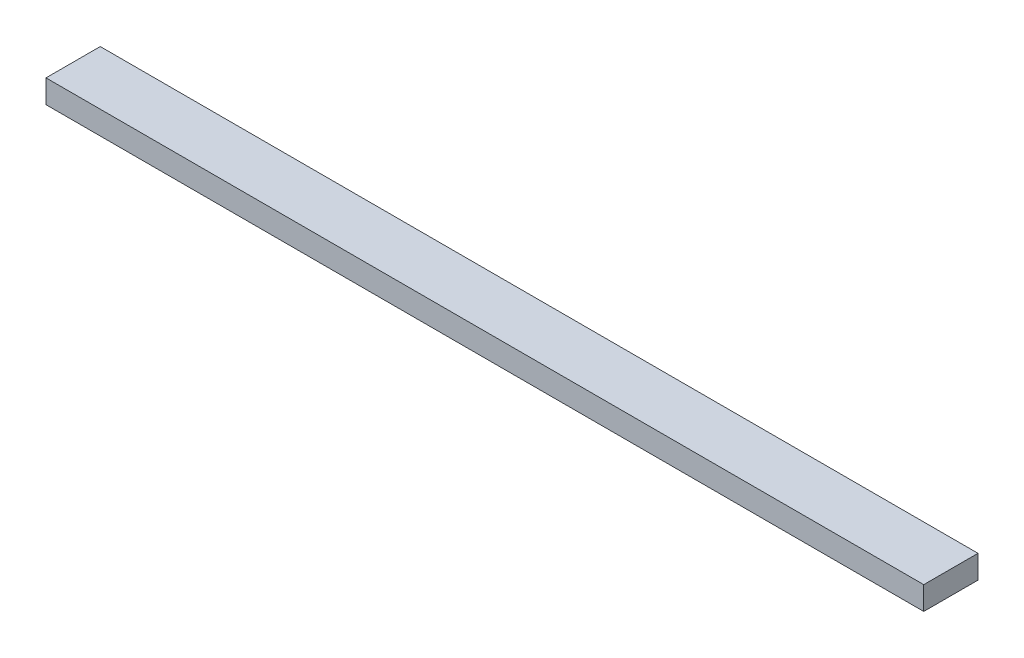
SolidWorks part; units mm, degrees
ref_plane "Front Plane" through (0, 0, 0) normal (0, 0, 1) x (1, 0, 0)
ref_plane "Top Plane" through (0, 0, 0) normal (0, 1, 0) x (1, 0, 0)
ref_plane "Right Plane" through (0, 0, 0) normal (1, 0, 0) x (0, 0, -1)
sketch "Sketch1" plane through (0, 0, 0) normal (1, 0, 0) x (0, 0, -1)
  line L1 (0, 0) -> (88.9, 0)
  line L2 (0, 0) -> (0, 38.1)
  line L3 (0, 38.1) -> (88.9, 38.1)
  line L4 (88.9, 0) -> (88.9, 38.1)
  dimension "D1" = 38.1
  dimension "D2" = 88.9
extrude "Boss-Extrude1" add sketch "Sketch1" along normal blind 1438.275
